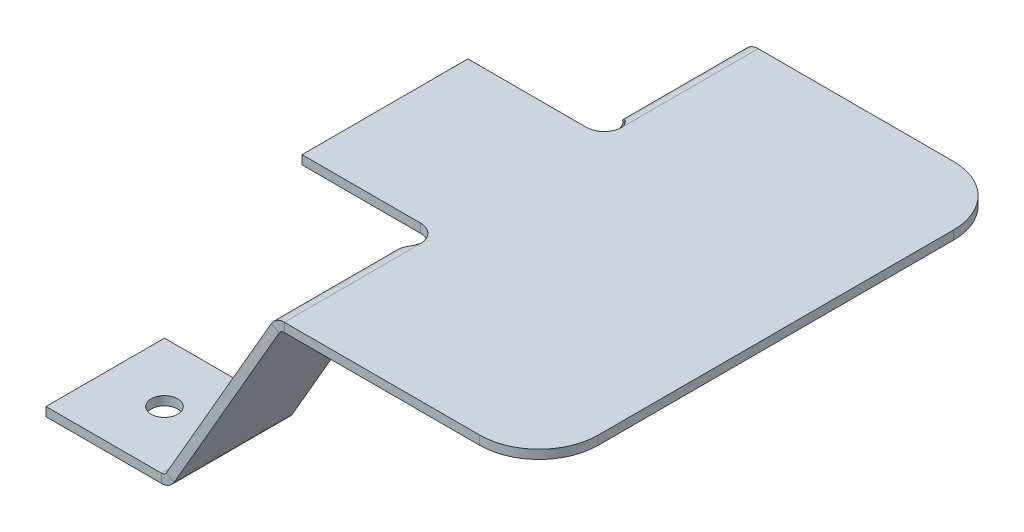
SolidWorks part; units mm, degrees
ref_plane "Front Plane" through (0, 0, 0) normal (0, 0, 1) x (1, 0, 0)
ref_plane "Top Plane" through (0, 0, 0) normal (0, 1, 0) x (1, 0, 0)
ref_plane "Right Plane" through (0, 0, 0) normal (1, 0, 0) x (0, 0, -1)
sketch "Sketch1" plane through (0, 0, 0) normal (0, 1, 0) x (1, 0, 0)
  line L0 (0, 0) -> (90, 0)
  line L1 (100, 10) -> (100, 70)
  line L2 (90, 80) -> (0, 80)
  line L3 (0, 80) -> (0, 60)
  line L4 (0, 60) -> (54, 60)
  line L5 (0, 70) -> (25.4498, 70) construction
  line L6 (57, 57) -> (57, 23)
  line L9 (0, 10) -> (25.4498, 10) construction
  line L10 (54, 20) -> (0, 20)
  line L11 (0, 20) -> (0, 0)
  arc A0 (57, 57) -> (54, 60) centre (54, 57) ccw
  arc A1 (54, 20) -> (57, 23) centre (54, 23) ccw
  arc A2 (100, 70) -> (90, 80) centre (90, 70) ccw
  arc A3 (90, 0) -> (100, 10) centre (90, 10) ccw
  circle A4 centre (10, 70) radius 2.25
  circle A5 centre (10, 10) radius 2.25
  dimension "D1" = 10
  dimension "D2" = 4.5
  dimension "D3" = 4.5
  dimension "D4" = 3
  dimension "D5" = 3
  dimension "D10" = 54
  dimension "D11" = 46
  dimension "D12" = 10
  dimension "D13" = 10
  dimension "D6" = 34
  dimension "D7" = 20
  dimension "D8" = 20
  dimension "D14" = 80
  dimension "D16" = 100
sheet metal parameters "Sheet-Metal1" thickness 1.5 parameters "D1"=1
base flange "Base-Flange1" sketch "Sketch1" thickness 1.5 reverse thickness direction yes parameters "D1"=1
sketch "Sketch3" plane through (0, 1.5, 0) normal (0, 1, 0) x (1, 0, 0)
  line L0 (20, 80) -> (20, 0)
  line L1 (90, 80) -> (0, 80) construction
  line L2 (0, 0) -> (90, 0) construction
  line L3 (0, 20) -> (0, 0) construction
  dimension "D1" = 20
sketched bend "Sketched Bend1" parameters "D1"=1
bend "SketchBend1" bend radius 1 bend angle 60 parameters "D5"=1
sketch "Sketch4" plane through (0, 1.5, 0) normal (0, 1, 0) x (1, 0, 0)
  line L1 (20.5236, 0) -> (90, 0) construction
  line L2 (57, 57) -> (57, 80)
  line L4 (90, 80) -> (20.5236, 80) construction
  line L5 (57, 23) -> (57, 0)
sketched bend "Sketched Bend4" parameters "D1"=1
bend "SketchBend5" bend radius 1 bend angle 60 parameters "D5"=2
sketch "Sketch7" plane through (0, 1.5, 0) normal (0, 1, 0) x (1, 0, 0)
  line L0 (54, 54) -> (34, 54)
  line L2 (34, 54) -> (34, 26)
  line L3 (34, 26) -> (54, 26)
  line L4 (57, 57) -> (57, 23)
  line L7 (34, 40) -> (100, 40) construction
  line L8 (100, 10) -> (100, 70) construction
  arc A0 (54, 54) -> (57, 57) centre (54, 57) ccw
  arc A1 (57, 23) -> (54, 26) centre (54, 23) ccw
  dimension "D1" = 6
  dimension "D2" = 6
  dimension "D3" = 28
  dimension "D4" = 23
base flange "Tab1" sketch "Sketch7" thickness 1.5 reverse thickness direction yes parameters "D1"=1
flat pattern "Flat-Pattern1"
sketch "Bend-Lines1" plane through (0, 0, 0) normal (0, 1, 0) x (-1, 0, 0)
bend of the flat pattern "Flatten-<SketchBend1>1"
bend of the flat pattern "Flatten-<SketchBend5>1"
